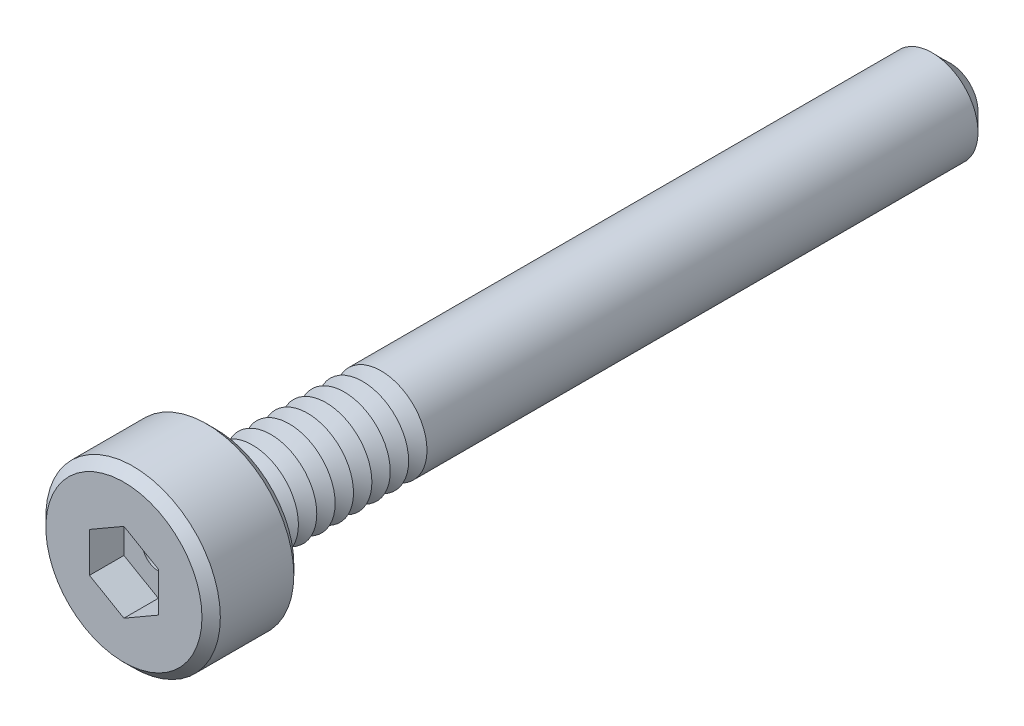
SolidWorks part; units mm, degrees
ref_plane "Front Plane" through (0, 0, 0) normal (0, 0, 1) x (1, 0, 0)
ref_plane "Top Plane" through (0, 0, 0) normal (0, 1, 0) x (1, 0, 0)
ref_plane "Right Plane" through (0, 0, 0) normal (1, 0, 0) x (0, 0, -1)
sketch "Sketch1" plane through (0, 0, 0) normal (0, 0, 1) x (1, 0, 0)
  circle A0 centre (0, 0) radius 1.9
  dimension "D1" = 3.8
extrude "Boss-Extrude1" add sketch "Sketch1" along normal blind 2
sketch "Sketch2" plane through (0, 0, 0) normal (0, 0, -1) x (-1, 0, 0)
  circle A0 centre (0, 0) radius 1
  dimension "D1" = 2
extrude "Boss-Extrude2" add sketch "Sketch2" along normal blind 16
chamfer "Chamfer1" distance 0.4 angle 45 1 edges at (-1, 0, -16)
sketch "Sketch3" plane through (0, 0, 0) normal (1, 0, 0) x (0, 0, -1)
  line L0 (-2.5121, 0) -> (4.5776, 0) construction
sketch "Sketch4" plane through (0, 0, 0) normal (1, 0, 0) x (0, 0, -1)
  line L0 (0, 1) -> (0.2, 0.6536)
  line L1 (0.2, 0.6536) -> (0.4, 1)
  line L2 (15.6, 1) -> (0, 1) construction
  line L3 (0.4, 1) -> (0, 1)
  dimension "D1" = 0.4
revolve "Cut-Revolve1" cut sketch "Sketch4" angle 360 about L0
pattern_linear "LPattern1" count 9 spacing 0.4 along (0, 0, -1) of "Cut-Revolve1"
sketch "Sketch5" plane through (0, 0, 2) normal (0, 0, 1) x (1, 0, 0)
  line L1 (0, 0.866) -> (-0.75, 0.433)
  line L2 (-0.75, 0.433) -> (-0.75, -0.433)
  line L3 (-0.75, -0.433) -> (0, -0.866)
  line L4 (0, -0.866) -> (0.75, -0.433)
  line L5 (0.75, -0.433) -> (0.75, 0.433)
  line L6 (0.75, 0.433) -> (0, 0.866)
  circle A0 centre (0, 0) radius 0.75 construction
  dimension "D1" = 1.5
extrude "Cut-Extrude1" cut sketch "Sketch5" against normal blind 0.75
sketch "Sketch6" plane through (0, 0, 1.25) normal (0, 0, 1) x (1, 0, 0)
  circle A0 centre (0, 0) radius 0.35
  dimension "D1" = 0.7
extrude "Cut-Extrude2" cut sketch "Sketch6" against normal up to surface (17.25 mm away)
chamfer "Chamfer2" distance 0.2 angle 45 2 edges at (1.9, 0, 0) (1.9, 0, 2)
